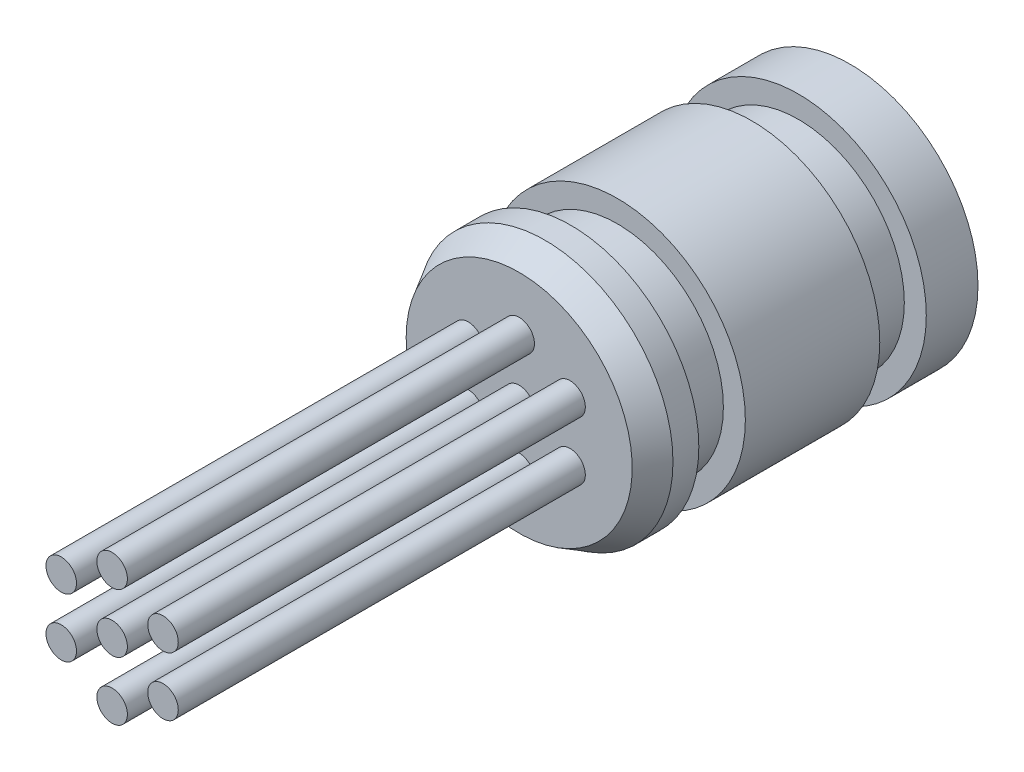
SolidWorks part; units mm, degrees
other "NONE"
ref_plane "Front Plane" through (0, 0, 0) normal (0, 0, 1) x (1, 0, 0)
ref_plane "Top Plane" through (0, 0, 0) normal (0, 1, 0) x (1, 0, 0)
ref_plane "Right Plane" through (0, 0, 0) normal (1, 0, 0) x (0, 0, -1)
imported_body "Imported1"
sketch "Sketch1" plane through (0, 0, 16.256) normal (0, 0, 1) x (1, 0, 0)
  line L0 (0, 0) -> (0, 2.8868) construction
  line L2 (0, 2.8868) -> (-2.5, 1.4434) construction
  line L3 (-2.5, 1.4434) -> (-2.5, -1.4434) construction
  line L4 (-2.5, -1.4434) -> (0, -2.8868) construction
  line L5 (0, -2.8868) -> (2.5, -1.4434) construction
  line L6 (2.5, -1.4434) -> (2.5, 1.4434) construction
  line L7 (2.5, 1.4434) -> (0, 2.8868) construction
  circle A0 centre (0, 0) radius 0.75
  circle A1 centre (0, 2.8868) radius 0.75
  circle A2 centre (0, 0) radius 2.5 construction
  circle A3 centre (2.5, 1.4434) radius 0.75
  circle A4 centre (2.5, -1.4434) radius 0.75
  circle A5 centre (0, -2.8868) radius 0.75
  circle A6 centre (-2.5, -1.4434) radius 0.75
  circle A7 centre (-2.5, 1.4434) radius 0.75
  dimension "D1" = 1.5
  dimension "D2" = 5
extrude "Boss-Extrude1" add sketch "Sketch1" along normal blind 20
